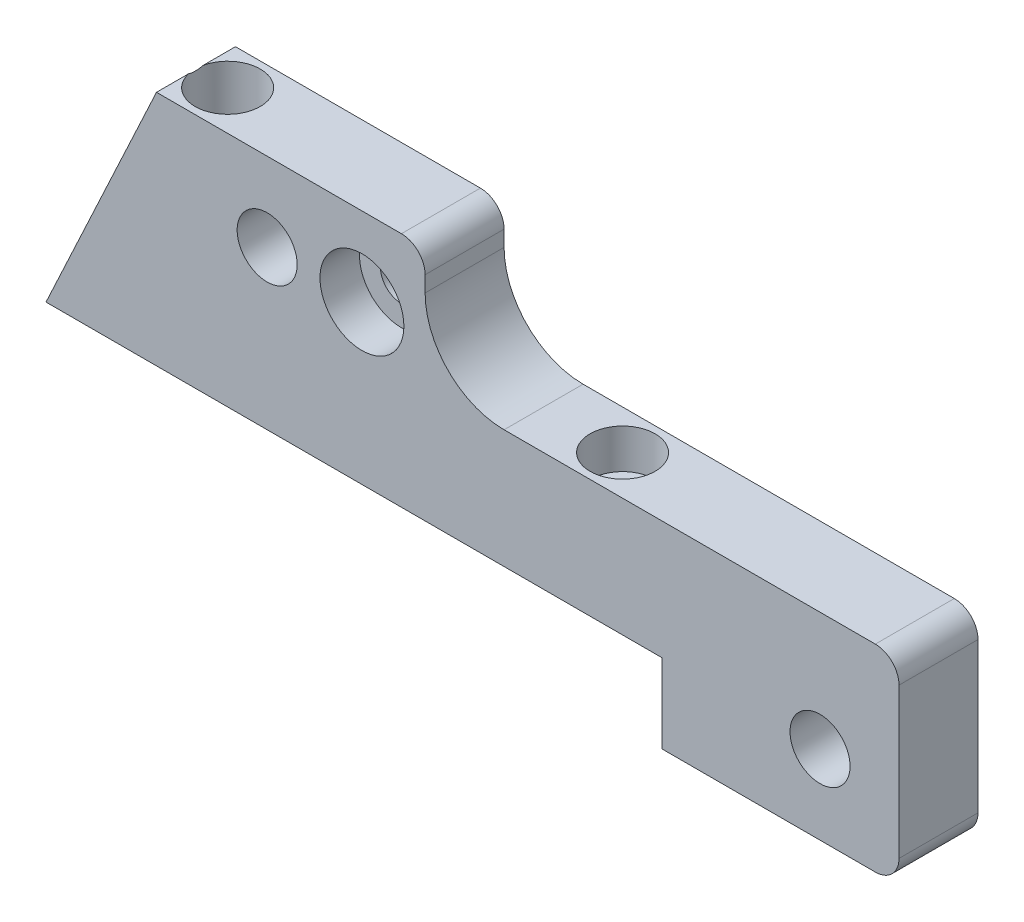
SolidWorks part; units mm, degrees
ref_plane "Front Plane" through (0, 0, 0) normal (0, 0, 1) x (1, 0, 0)
ref_plane "Top Plane" through (0, 0, 0) normal (0, 1, 0) x (1, 0, 0)
ref_plane "Right Plane" through (0, 0, 0) normal (1, 0, 0) x (0, 0, -1)
sketch "Sketch1" plane through (0, 0, 0) normal (0, 0, 1) x (1, 0, 0)
  line L0 (-1000, 0) -> (49000, 0) construction
  line L1 (0, -1000) -> (0, 49000) construction
  line L2 (0, 0) -> (-99.06, 0)
  line L3 (-99.06, 0) -> (-81.2937, 38.1)
  line L4 (-81.2937, 38.1) -> (-41.91, 38.1)
  line L5 (-38.1, 34.29) -> (-38.1, 31.75)
  line L6 (-25.4, 19.05) -> (34.29, 19.05)
  line L7 (38.1, 15.24) -> (38.1, -8.89)
  line L8 (34.29, -12.7) -> (0, -12.7)
  line L9 (0, -12.7) -> (0, 0)
  circle A0 centre (-63.5, 25.4) radius 4.826
  circle A1 centre (25.4, 0) radius 4.826
  arc A2 (38.1, -8.89) -> (34.29, -12.7) centre (34.29, -8.89) cw
  arc A3 (34.29, 19.05) -> (38.1, 15.24) centre (34.29, 15.24) cw
  arc A4 (-41.91, 38.1) -> (-38.1, 34.29) centre (-41.91, 34.29) cw
  arc A5 (-38.1, 31.75) -> (-25.4, 19.05) centre (-25.4, 31.75) ccw
  dimension "D1" = 3.81
  dimension "D2" = 12.7
  dimension "D14" = 9.652
  dimension "D3" = 65
  dimension "D4" = 12.7
  dimension "D5" = 31.75
  dimension "D6" = 38.1
  dimension "D7" = 50.8
  dimension "D8" = 12.7
  dimension "D9" = 38.1
  dimension "D10" = 12.7
  dimension "D11" = 76.2
  dimension "D12" = 137.16
  dimension "D13" = 101.6
extrude "Boss-Extrude1" add sketch "Sketch1" along normal mid plane 12.7
sketch "Sketch2" plane through (0, 0, 6.35) normal (0, 0, 1) x (1, 0, 0)
  line L0 (38.1, -8.89) -> (38.1, 15.24) construction
  point P0 (-48.26, 25.4)
  point P6 (-63.5, 25.4)
  dimension "D1" = 86.36
hole_wizard "CBORE for 1/4 Pan Head Machine Screw1" positions "Sketch3" profile "Sketch4" counterbore size "1/4" standard "ANSI Inch"
sketch "Sketch3" plane through (0, 0, 6.35) normal (0, 0, 1) x (1, 0, 0)
  point P0 (-48.26, 25.4)
sketch "Sketch4" plane through (-48.26, 25.4, 6.35) normal (1, 0, 0) x (0, -1, 0)
  line L0 (0, 0) -> (0, 19.5558)
  line L1 (0, 19.5558) -> (3.3782, 17.526)
  line L2 (3.3782, 17.526) -> (3.3782, 6.35)
  line L3 (3.3782, 6.35) -> (6.7462, 6.35)
  line L4 (6.7462, 6.35) -> (6.7462, 0)
  line L5 (6.7462, 0) -> (0, 0)
  line L10 (0, 19.5558) -> (-3.3782, 17.526) construction
  line L11 (0, -6.35) -> (0, 107.95) construction
  dimension "Hole Dia." = 6.7564
  dimension "Hole Depth" = 17.526
  dimension "C'Bore Dia." = 13.4925
  dimension "C'Bore Depth" = 6.35
  dimension "Drill Angle" = 118
sketch "Sketch5" plane through (0, 38.1, 0) normal (0, 1, 0) x (1, 0, 0)
  line L0 (38.1, -6.35) -> (38.1, 6.35) construction
  point P0 (-76.2, 0)
  dimension "D1" = 114.3
hole_wizard "CBORE for 1/4 Pan Head Machine Screw2" positions "Sketch6" profile "Sketch7" counterbore size "1/4" standard "ANSI Inch"
sketch "Sketch6" plane through (0, 38.1, 0) normal (0, 1, 0) x (1, 0, 0)
  point P0 (-76.2, 0)
  dimension "D1" = 76.2
sketch "Sketch7" plane through (-76.2, 38.1, 0) normal (1, 0, 0) x (0, 0, 1)
  line L0 (0, 0) -> (0, 50.8)
  line L1 (0, 50.8) -> (3.3782, 50.8)
  line L3 (3.3782, 50.8) -> (3.3782, 19.05)
  line L4 (3.3782, 19.05) -> (5.2324, 19.05)
  line L5 (5.2324, 19.05) -> (5.2324, 0)
  line L7 (5.2324, 0) -> (0, 0)
  line L11 (0, -6.35) -> (0, 107.95) construction
  dimension "Thru Hole Dia." = 6.7564
  dimension "Thru Hole Depth" = 50.8
  dimension "C'Bore Dia." = 10.4648
  dimension "C'Bore Depth" = 19.05
sketch "Sketch8" plane through (0, 19.05, 0) normal (0, 1, 0) x (1, 0, 0)
  line L0 (38.1, -6.35) -> (38.1, 6.35) construction
  point P0 (-12.7, 0)
  point P3 (38.1, 0)
  dimension "D1" = 50.8
hole_wizard "CBORE for 1/4 Pan Head Machine Screw3" positions "Sketch9" profile "Sketch10" counterbore size "1/4" standard "ANSI Inch"
sketch "Sketch9" plane through (0, 19.05, 0) normal (0, 1, 0) x (1, 0, 0)
  point P0 (-12.7, 0)
sketch "Sketch10" plane through (-12.7, 19.05, 0) normal (1, 0, 0) x (0, 0, 1)
  line L0 (0, 0) -> (0, 31.75)
  line L1 (0, 31.75) -> (3.3782, 31.75)
  line L3 (3.3782, 31.75) -> (3.3782, 6.35)
  line L4 (3.3782, 6.35) -> (5.2324, 6.35)
  line L5 (5.2324, 6.35) -> (5.2324, 0)
  line L7 (5.2324, 0) -> (0, 0)
  line L11 (0, -6.35) -> (0, 107.95) construction
  dimension "Thru Hole Dia." = 6.7564
  dimension "Thru Hole Depth" = 31.75
  dimension "C'Bore Dia." = 10.4648
  dimension "C'Bore Depth" = 6.35
